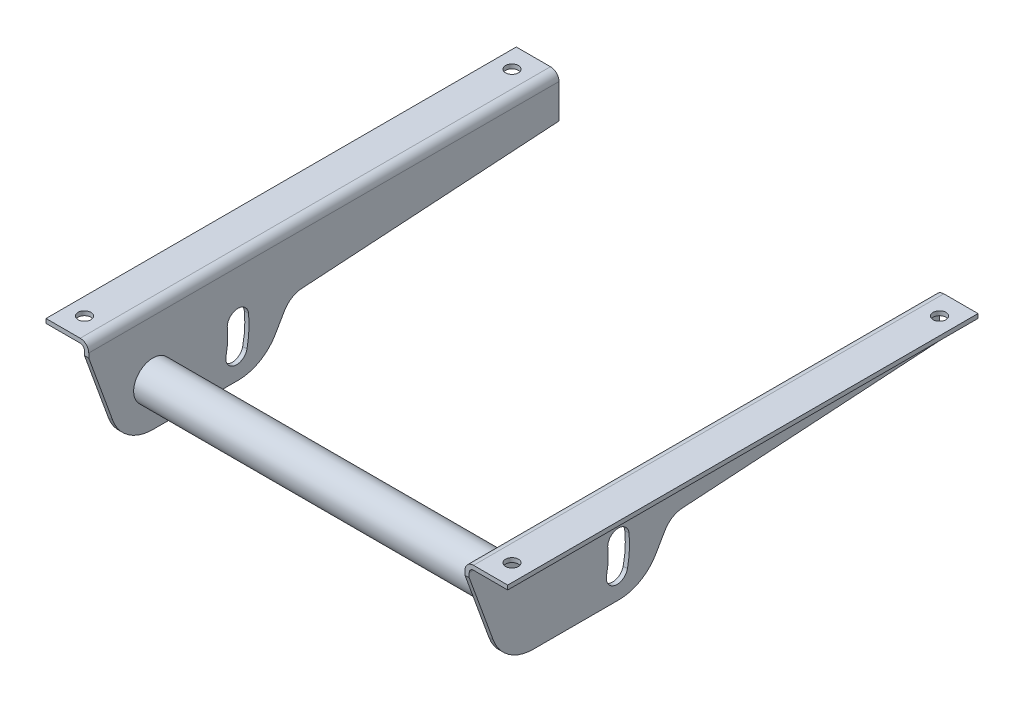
SolidWorks part; units mm, degrees
ref_plane "Plan de face" through (0, 0, 0) normal (0, 0, 1) x (1, 0, 0)
ref_plane "Plan de dessus" through (0, 0, 0) normal (0, 1, 0) x (1, 0, 0)
ref_plane "Plan de droite" through (0, 0, 0) normal (1, 0, 0) x (0, 0, -1)
sketch "Esquisse1" plane through (0, 0, 0) normal (0, 0, 1) x (1, 0, 0)
  line L0 (-108, -2) -> (-92, -2)
  line L1 (-90, -4) -> (-90, -50)
  line L2 (0, -27.5) -> (0, 27.5) construction
  line L3 (11, 0) -> (-11, 0) construction
  arc A0 (-92, -2) -> (-90, -4) centre (-92, -4) cw
  point P9 (-90, -2)
  dimension "D5" = 2
  dimension "D1" = 48
  dimension "D2" = 18
  dimension "D3" = 90
  dimension "D4" = 2
extrude "Extru.-Mince1" add sketch "Esquisse1" along normal blind 190 and the other way blind 30 thin
sketch "Esquisse2" plane through (0, 0, 0) normal (1, 0, 0) x (0, 0, -1)
  line L0 (30, -50) -> (-190, -50) construction
  line L1 (-190, -4) -> (-190, -50) construction
  line L2 (-178.7939, -36.8404) -> (-190, -6.0518)
  line L3 (30, -20) -> (-90.4047, -27.6599)
  line L4 (30, -4) -> (30, -50) construction
  line L5 (118.8, 0) -> (-118.8, 0) construction
  line L6 (-102.6795, -40) -> (-98.43, -32.6397)
  line L7 (-190, -6.0518) -> (-190, -50)
  line L8 (-190, -50) -> (-160, -50)
  line L9 (-120, -50) -> (30, -50)
  line L10 (30, -50) -> (30, -20)
  line L11 (-160, -30) -> (-120.8741, -38.3165) construction
  line L12 (-160, -30) -> (-120.2191, -25.8189) construction
  arc A0 (-178.7939, -36.8404) -> (-160, -50) centre (-160, -30) ccw
  arc A1 (-120, -30) -> (-120.2191, -25.8189) centre (-160, -30) ccw construction
  arc A2 (-120.2191, -25.8189) -> (-120.8741, -38.3165) centre (-160, -30) cw construction
  arc A3 (-115.9834, -39.356) -> (-115.2465, -25.2962) centre (-160, -30) ccw
  arc A4 (-125.7648, -37.2769) -> (-125.1917, -26.3415) centre (-160, -30) ccw
  arc A5 (-125.7648, -37.2769) -> (-115.9834, -39.356) centre (-120.8741, -38.3165) ccw
  arc A6 (-115.2465, -25.2962) -> (-125.1917, -26.3415) centre (-120.2191, -25.8189) ccw
  arc A7 (-120, -50) -> (-102.6795, -40) centre (-120, -30) ccw
  arc A8 (-90.4047, -27.6599) -> (-98.43, -32.6397) centre (-89.7698, -37.6397) ccw
  point P11 (-120.0548, -32.0934)
  point P26 (-95.7513, -28)
  dimension "D1" = 20
  dimension "D4" = 40
  dimension "D6" = 5
  dimension "D9" = 10
  dimension "D5" = 12
  dimension "D2" = 30
  dimension "D3" = 20
  dimension "D7" = 20
  dimension "D8" = 28
  dimension "D10" = 60
  dimension "D11" = 18
extrude "Extrusion1" cut sketch "Esquisse2" against normal through all
sketch "Esquisse3" plane through (0, 0, 0) normal (0, 1, 0) x (1, 0, 0)
  line L0 (-11, 0) -> (11, 0) construction
  line L1 (0, -27.5) -> (0, 27.5) construction
  circle A0 centre (-100, -180) radius 3
  circle A1 centre (-100, 20) radius 3
  dimension "D2" = 200
  dimension "D3" = 6
  dimension "D4" = 100
  dimension "D1" = 20
extrude "Extrusion2" cut sketch "Esquisse3" against normal through all
sketch "Esquisse4" plane through (-88, 0, 0) normal (1, 0, 0) x (0, 0, -1)
  circle A0 centre (-160, -30) radius 9
  circle A1 centre (-160, -30) radius 6
  arc A2 (-178.7939, -36.8404) -> (-160, -50) centre (-160, -30) ccw construction
  dimension "D2" = 18
  dimension "D1" = 3
extrude "Extrusion3" add sketch "Esquisse4" along normal up to surface (88 mm away)
mirror "Symétrie2" about plane through (0, 0, 0) normal (1, 0, 0)
